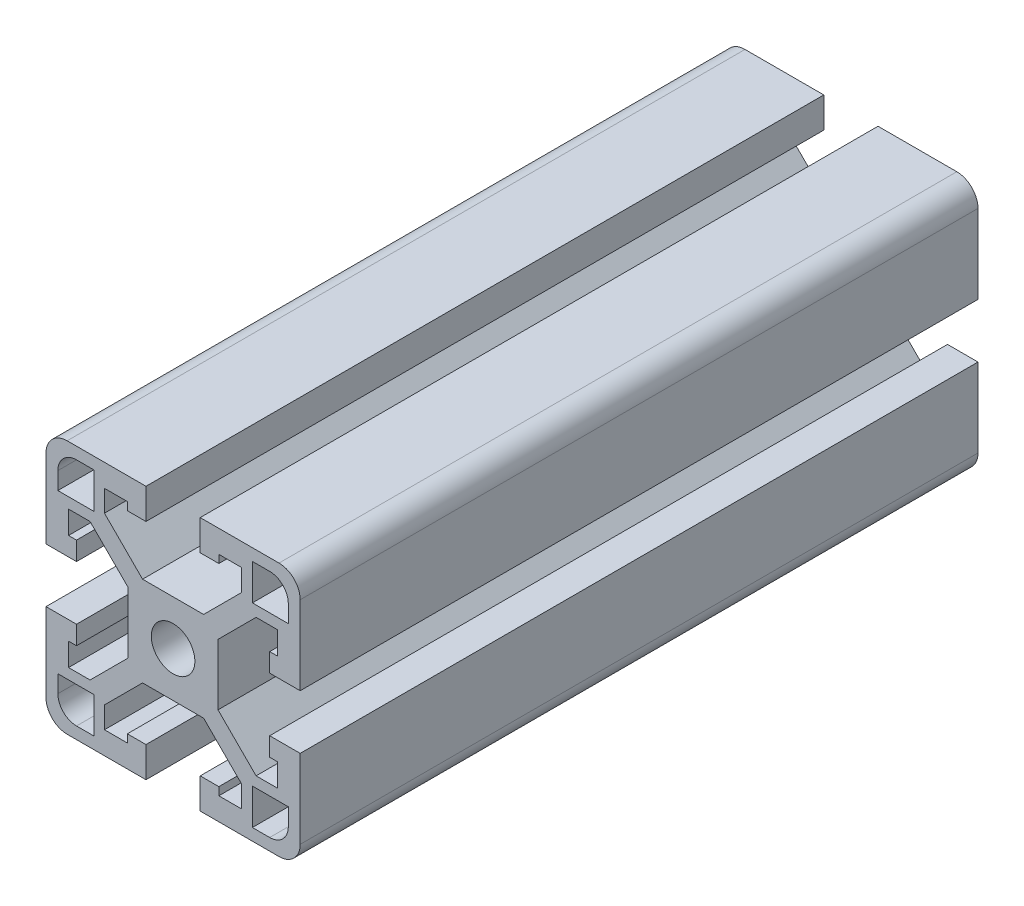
SolidWorks part; units mm, degrees
ref_plane "Front" through (0, 0, 0) normal (0, 0, 1) x (1, 0, 0)
ref_plane "Top" through (0, 0, 0) normal (0, 1, 0) x (1, 0, 0)
ref_plane "Right" through (0, 0, 0) normal (1, 0, 0) x (0, 0, -1)
sketch "Sketch1" plane through (0, 0, 0) normal (0, 0, 1) x (1, 0, 0)
  line L0 (-11.8872, 17.272) -> (-14.478, 17.272)
  line L1 (-11.8872, 11.8872) -> (-11.8872, 17.272)
  line L2 (-17.272, 11.8872) -> (-11.8872, 11.8872)
  line L3 (-17.272, 14.478) -> (-17.272, 11.8872)
  line L4 (14.478, 17.272) -> (11.8872, 17.272)
  line L5 (17.272, 11.8872) -> (17.272, 14.478)
  line L6 (11.8872, 11.8872) -> (17.272, 11.8872)
  line L7 (11.8872, 17.272) -> (11.8872, 11.8872)
  line L8 (11.8872, -17.272) -> (14.478, -17.272)
  line L9 (11.8872, -11.8872) -> (11.8872, -17.272)
  line L10 (17.272, -11.8872) -> (11.8872, -11.8872)
  line L11 (17.272, -14.478) -> (17.272, -11.8872)
  line L12 (-14.478, -17.272) -> (-11.8872, -17.272)
  line L13 (-17.272, -11.8872) -> (-17.272, -14.478)
  line L14 (-11.8872, -11.8872) -> (-17.272, -11.8872)
  line L15 (-11.8872, -17.272) -> (-11.8872, -11.8872)
  line L16 (-6.731, 4.5757) -> (-6.731, -4.5757)
  line L17 (-6.731, -4.5757) -> (-12.4423, -10.287)
  line L18 (-12.4423, -10.287) -> (-15.6718, -10.287)
  line L19 (-15.6718, -10.287) -> (-15.6718, -6.858)
  line L20 (-15.6718, -6.858) -> (-14.478, -6.858)
  line L21 (-14.478, -6.858) -> (-14.478, -4.064)
  line L22 (-14.478, -4.064) -> (-19.05, -4.064)
  line L23 (-19.05, -4.064) -> (-19.05, -15.875)
  line L24 (-15.875, -19.05) -> (-4.064, -19.05)
  line L25 (-4.064, -19.05) -> (-4.064, -14.478)
  line L26 (-4.064, -14.478) -> (-6.858, -14.478)
  line L27 (-6.858, -14.478) -> (-6.858, -15.6718)
  line L28 (-6.858, -15.6718) -> (-10.287, -15.6718)
  line L29 (-10.287, -15.6718) -> (-10.287, -12.4423)
  line L30 (-10.287, -12.4423) -> (-4.5757, -6.731)
  line L31 (-4.5757, -6.731) -> (4.5757, -6.731)
  line L32 (4.5757, -6.731) -> (10.287, -12.4423)
  line L33 (10.287, -12.4423) -> (10.287, -15.6718)
  line L34 (10.287, -15.6718) -> (6.858, -15.6718)
  line L35 (6.858, -15.6718) -> (6.858, -14.478)
  line L36 (6.858, -14.478) -> (4.064, -14.478)
  line L37 (4.064, -14.478) -> (4.064, -19.05)
  line L38 (4.064, -19.05) -> (15.875, -19.05)
  line L39 (19.05, -15.875) -> (19.05, -4.064)
  line L40 (19.05, -4.064) -> (14.478, -4.064)
  line L41 (14.478, -4.064) -> (14.478, -6.858)
  line L42 (14.478, -6.858) -> (15.6718, -6.858)
  line L43 (15.6718, -6.858) -> (15.6718, -10.287)
  line L44 (15.6718, -10.287) -> (12.4423, -10.287)
  line L45 (12.4423, -10.287) -> (6.731, -4.5757)
  line L46 (6.731, -4.5757) -> (6.731, 4.5757)
  line L47 (6.731, 4.5757) -> (12.4423, 10.287)
  line L48 (12.4423, 10.287) -> (15.6718, 10.287)
  line L49 (15.6718, 10.287) -> (15.6718, 6.858)
  line L50 (15.6718, 6.858) -> (14.478, 6.858)
  line L51 (14.478, 6.858) -> (14.478, 4.064)
  line L52 (14.478, 4.064) -> (19.05, 4.064)
  line L53 (19.05, 4.064) -> (19.05, 15.875)
  line L54 (15.875, 19.05) -> (4.064, 19.05)
  line L55 (4.064, 19.05) -> (4.064, 14.478)
  line L56 (4.064, 14.478) -> (6.858, 14.478)
  line L57 (6.858, 14.478) -> (6.858, 15.6718)
  line L58 (6.858, 15.6718) -> (10.287, 15.6718)
  line L59 (10.287, 15.6718) -> (10.287, 12.4423)
  line L60 (10.287, 12.4423) -> (4.5757, 6.731)
  line L61 (4.5757, 6.731) -> (-4.5757, 6.731)
  line L62 (-4.5757, 6.731) -> (-10.287, 12.4423)
  line L63 (-10.287, 12.4423) -> (-10.287, 15.6718)
  line L64 (-10.287, 15.6718) -> (-6.858, 15.6718)
  line L65 (-6.858, 15.6718) -> (-6.858, 14.478)
  line L66 (-6.858, 14.478) -> (-4.064, 14.478)
  line L67 (-4.064, 14.478) -> (-4.064, 19.05)
  line L68 (-4.064, 19.05) -> (-15.875, 19.05)
  line L69 (-19.05, 15.875) -> (-19.05, 4.064)
  line L70 (-19.05, 4.064) -> (-14.478, 4.064)
  line L71 (-14.478, 4.064) -> (-14.478, 6.858)
  line L72 (-14.478, 6.858) -> (-15.6718, 6.858)
  line L73 (-15.6718, 6.858) -> (-15.6718, 10.287)
  line L74 (-15.6718, 10.287) -> (-12.4423, 10.287)
  line L75 (-12.4423, 10.287) -> (-6.731, 4.5757)
  circle A0 centre (0, 0) radius 3.2639
  arc A1 (-19.05, -15.875) -> (-15.875, -19.05) centre (-15.875, -15.875) ccw
  arc A2 (15.875, -19.05) -> (19.05, -15.875) centre (15.875, -15.875) ccw
  arc A3 (19.05, 15.875) -> (15.875, 19.05) centre (15.875, 15.875) ccw
  arc A4 (-15.875, 19.05) -> (-19.05, 15.875) centre (-15.875, 15.875) ccw
  arc A5 (-14.478, 17.272) -> (-17.272, 14.478) centre (-14.478, 14.478) ccw
  arc A6 (17.272, 14.478) -> (14.478, 17.272) centre (14.478, 14.478) ccw
  arc A7 (14.478, -17.272) -> (17.272, -14.478) centre (14.478, -14.478) ccw
  arc A8 (-17.272, -14.478) -> (-14.478, -17.272) centre (-14.478, -14.478) ccw
extrude "Boss-Extrude1" add sketch "Sketch1" along normal mid plane 101.6
